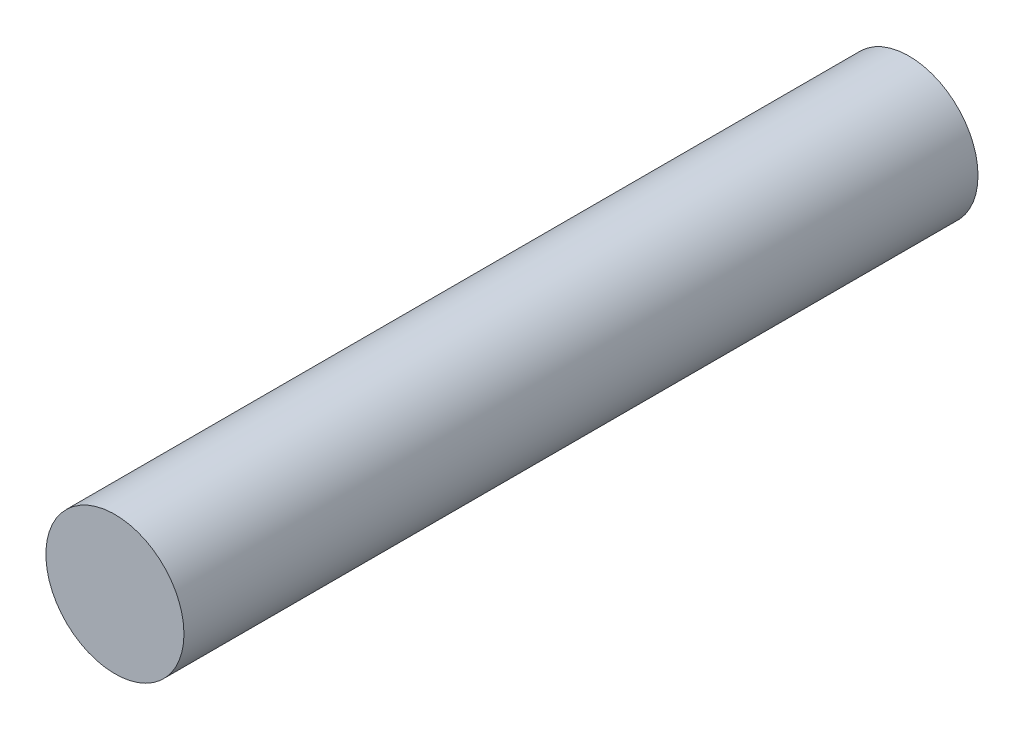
SolidWorks part; units mm, degrees
ref_plane "Plan1" through (0, 0, 0) normal (0, 0, 1) x (1, 0, 0)
ref_plane "Plan2" through (0, 0, 0) normal (0, 1, 0) x (1, 0, 0)
ref_plane "Plan3" through (0, 0, 0) normal (1, 0, 0) x (0, 0, -1)
sketch "Esquisse1" plane through (0, 0, 0) normal (0, 0, 1) x (1, 0, 0)
  circle A0 centre (0, 0) radius 1
  dimension "D1" = 2
extrude "Base-Extrusion" add sketch "Esquisse1" along normal blind 11.5
